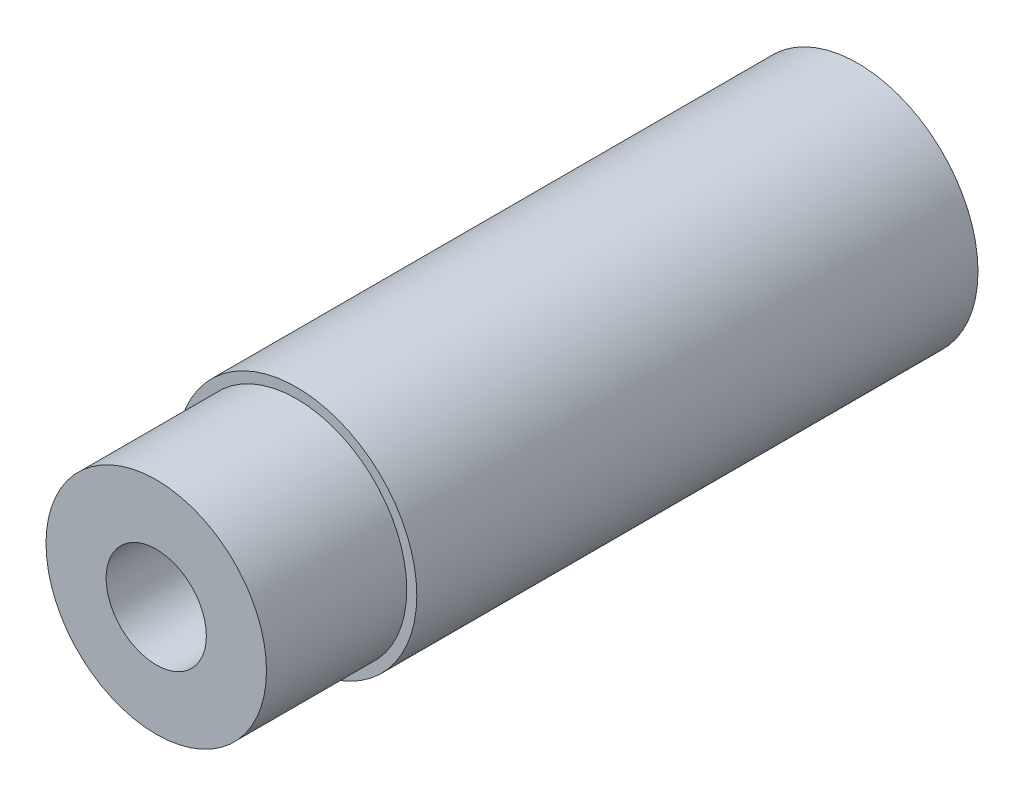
SolidWorks part; units mm, degrees
ref_plane "Přední rovina" through (0, 0, 0) normal (0, 0, 1) x (1, 0, 0)
ref_plane "Horní rovina" through (0, 0, 0) normal (0, 1, 0) x (1, 0, 0)
ref_plane "Pravá rovina" through (0, 0, 0) normal (1, 0, 0) x (0, 0, -1)
sketch "Skica1" plane through (0, 0, -21.9945) normal (0, 0, 1) x (1, 0, 0)
  circle A1 centre (-10, 0) radius 3
extrude "Vysunout1" add sketch "Skica1" along normal up to surface (14 mm away)
sketch "Skica2" plane through (0, 0, -7.9945) normal (0, 0, 1) x (1, 0, 0)
  circle A0 centre (-10, 0) radius 2.75
  circle A1 centre (-10, 0) radius 3 construction
  dimension "D1" = 5.5
extrude "Vysunout2" add sketch "Skica2" along normal blind 3.5
sketch "Skica3" plane through (0, 0, -4.4945) normal (0, 0, 1) x (1, 0, 0)
  circle A0 centre (-10, 0) radius 1.25
  dimension "D1" = 2.5
extrude "Odebrat vysunutím1" cut sketch "Skica3" against normal blind 3
